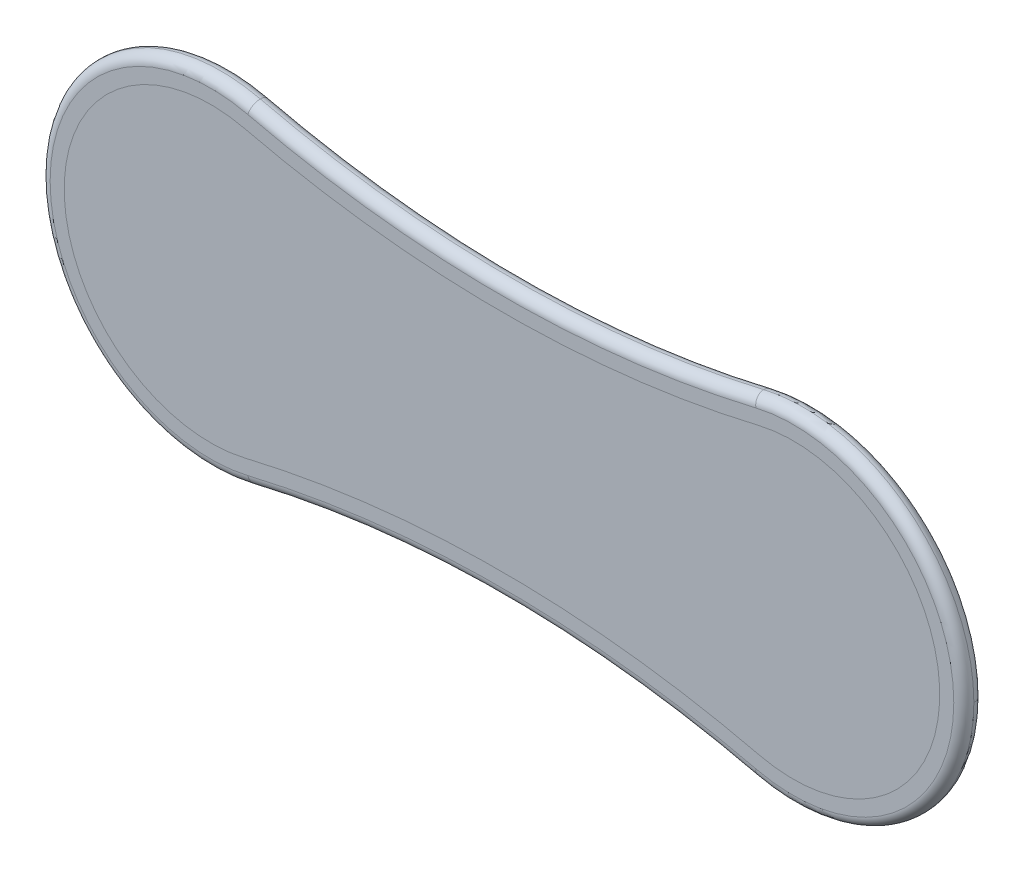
SolidWorks part; units mm, degrees
ref_plane "Face" through (0, 0, 0) normal (0, 0, 1) x (1, 0, 0)
ref_plane "Dessus" through (0, 0, 0) normal (0, 1, 0) x (1, 0, 0)
ref_plane "Droite" through (0, 0, 0) normal (1, 0, 0) x (0, 0, -1)
sketch "Esquisse1" plane through (0, 0, 0) normal (0, 0, 1) x (1, 0, 0)
  line L1 (0, 98.3384) -> (0, 0) construction
  arc A0 (-62.6696, 41.3475) -> (-62.6696, -41.3475) centre (-72.5, 0) ccw
  arc A1 (62.6696, -41.3475) -> (62.6696, 41.3475) centre (72.5, 0) ccw
  arc A2 (-62.6696, 41.3475) -> (62.6696, 41.3475) centre (0, 304.9412) ccw
  arc A3 (-62.6696, -41.3475) -> (62.6696, -41.3475) centre (0, -304.9412) cw
  point P4 (0, -34)
  point P7 (0, 34)
  dimension "D2" = 42.5
  dimension "D5" = 270.9412
  dimension "D1" = 145
  dimension "D3" = 34
  dimension "D4" = 68
extrude "Extrusion1" add sketch "Esquisse1" along normal blind 5
fillet "Congé1" radius 2.5 8 edges at (115, 0, 0) (0, -34, 0) (-115, 0, 0) (0, -34, 5) (-115, 0, 5) (0, 34, 5) (0, 34, 0) (115, 0, 5)
sketch "Esquisse2" plane through (0, 0, 5) normal (0, 0, 1) x (1, 0, 0)
  arc A8 (64.0574, -35.5102) -> (64.0574, 35.5102) centre (72.5, 0) ccw
  arc A9 (-64.0574, 35.5102) -> (64.0574, 35.5102) centre (0, 304.9412) ccw
  arc A10 (-64.0574, 35.5102) -> (-64.0574, -35.5102) centre (-72.5, 0) ccw
  arc A11 (64.0574, -35.5102) -> (-64.0574, -35.5102) centre (0, -304.9412) ccw
  arc A12 (64.0574, -35.5102) -> (64.0574, 35.5102) centre (72.5, 0) ccw
  arc A13 (-64.0574, 35.5102) -> (64.0574, 35.5102) centre (0, 304.9412) ccw
  arc A14 (-64.0574, 35.5102) -> (-64.0574, -35.5102) centre (-72.5, 0) ccw
  arc A15 (64.0574, -35.5102) -> (-64.0574, -35.5102) centre (0, -304.9412) ccw
  dimension "D1" = 6
sketch "Esquisse3" plane through (0, 0, 0) normal (0, 0, 1) x (1, 0, 0)
  line L0 (-115, 0) -> (115, 0)
  arc A0 (-62.6696, 41.3475) -> (-62.6696, -41.3475) centre (-72.5, 0) ccw construction
  arc A1 (62.6696, -41.3475) -> (62.6696, 41.3475) centre (72.5, 0) ccw construction
